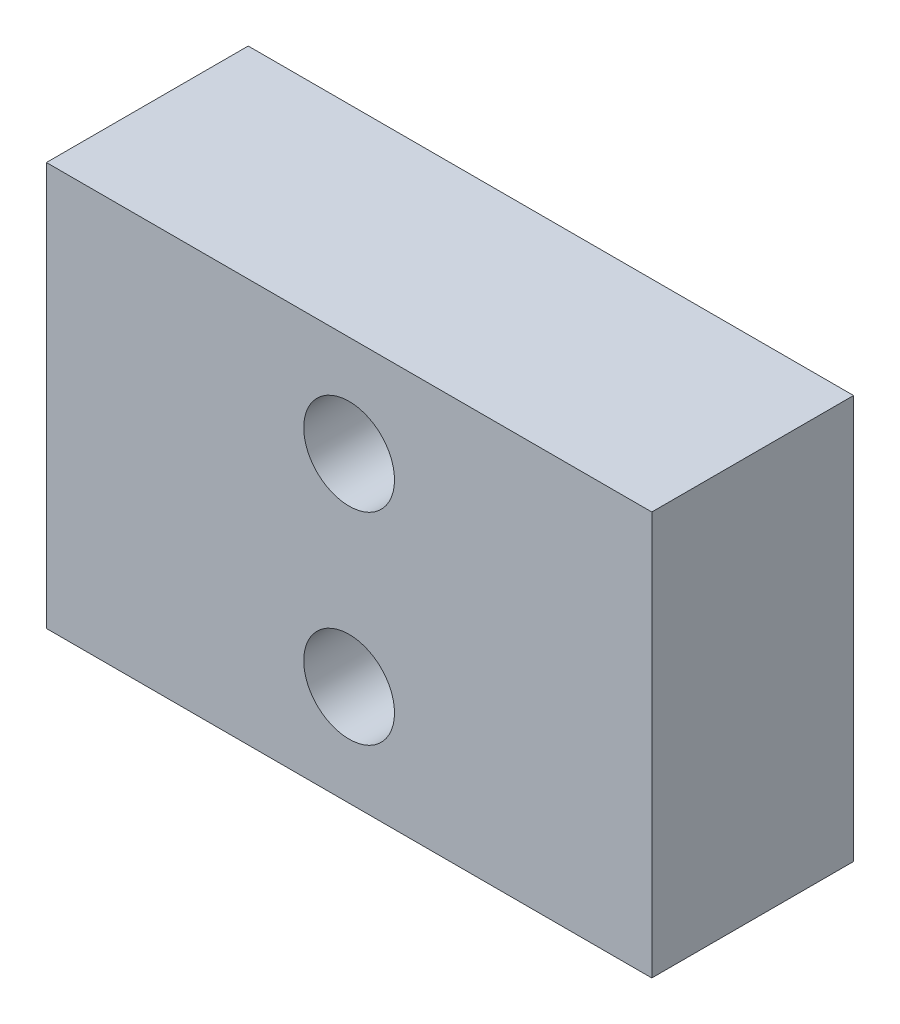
SolidWorks part; units mm, degrees
ref_plane "Спереди" through (0, 0, 0) normal (0, 0, 1) x (1, 0, 0)
ref_plane "Сверху" through (0, 0, 0) normal (0, 1, 0) x (1, 0, 0)
ref_plane "Справа" through (0, 0, 0) normal (1, 0, 0) x (0, 0, -1)
sketch "Эскиз1" plane through (0, 0, 0) normal (0, 0, 1) x (1, 0, 0)
  line L1 (15, 10) -> (-15, 10)
  line L2 (15, 10) -> (15, -10)
  line L3 (15, -10) -> (-15, -10)
  line L4 (-15, 10) -> (-15, -10)
  line L5 (15, 10) -> (-15, -10) construction
  line L6 (15, -10) -> (-15, 10) construction
  point P0 (0, 0)
  dimension "D1" = 30
  dimension "D2" = 20
extrude "Бобышка-Вытянуть1" add sketch "Эскиз1" along normal blind 10
hole_wizard "Отверстие с зазором M41" positions "Эскиз2" profile "Эскиз3" hole size "M4" standard "ISO"
sketch "Эскиз2" plane through (0, 0, 10) normal (0, 0, 1) x (1, 0, 0)
  line L0 (-15, 10) -> (-15, -10) construction
  line L1 (-15, -10) -> (15, -10) construction
  line L2 (15, 10) -> (-15, 10) construction
  point P0 (0, -5)
  point P7 (0, 5)
  dimension "D1" = 15
  dimension "D2" = 5
  dimension "D3" = 5
  dimension "D4" = 15
sketch "Эскиз3" plane through (0, -5, 10) normal (1, 0, 0) x (0, -1, 0)
  line L0 (0, 0) -> (0, 10)
  line L1 (0, 10) -> (2.25, 10)
  line L2 (2.25, 10) -> (2.25, 0)
  line L5 (2.25, 0) -> (0, 0)
  line L11 (0, -6.35) -> (0, 107.95) construction
  dimension "Диаметр сквозного отверстия" = 4.5
  dimension "Глубина сквозного отверстия" = 10
